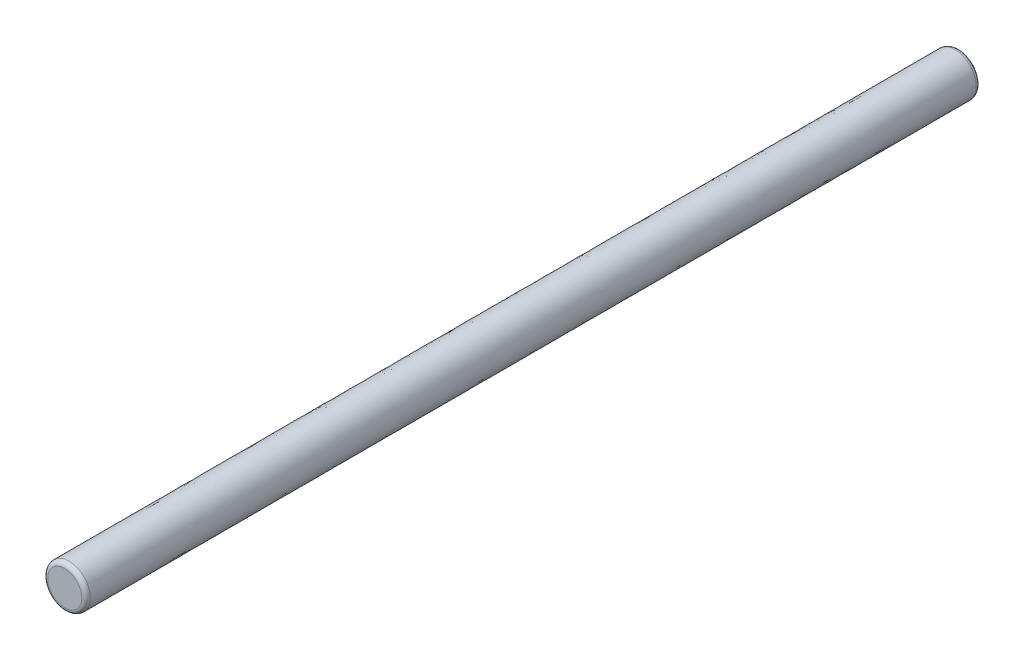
SolidWorks part; units mm, degrees
ref_plane "Plan1" through (0, 0, 0) normal (0, 0, 1) x (1, 0, 0)
ref_plane "Plan2" through (0, 0, 0) normal (0, 1, 0) x (1, 0, 0)
ref_plane "Plan3" through (0, 0, 0) normal (1, 0, 0) x (0, 0, -1)
sketch "Esquisse1" plane through (0, 0, 0) normal (0, 0, 1) x (1, 0, 0)
  circle A0 centre (0, 0) radius 2.5
  dimension "D1" = 5
extrude "Base-Extrusion" add sketch "Esquisse1" along normal mid plane 105
fillet "Congé1" radius 0.5 2 edges at (2.5, 0, -52.5) (2.5, 0, 52.5)
other "Fonction de déformation1"
